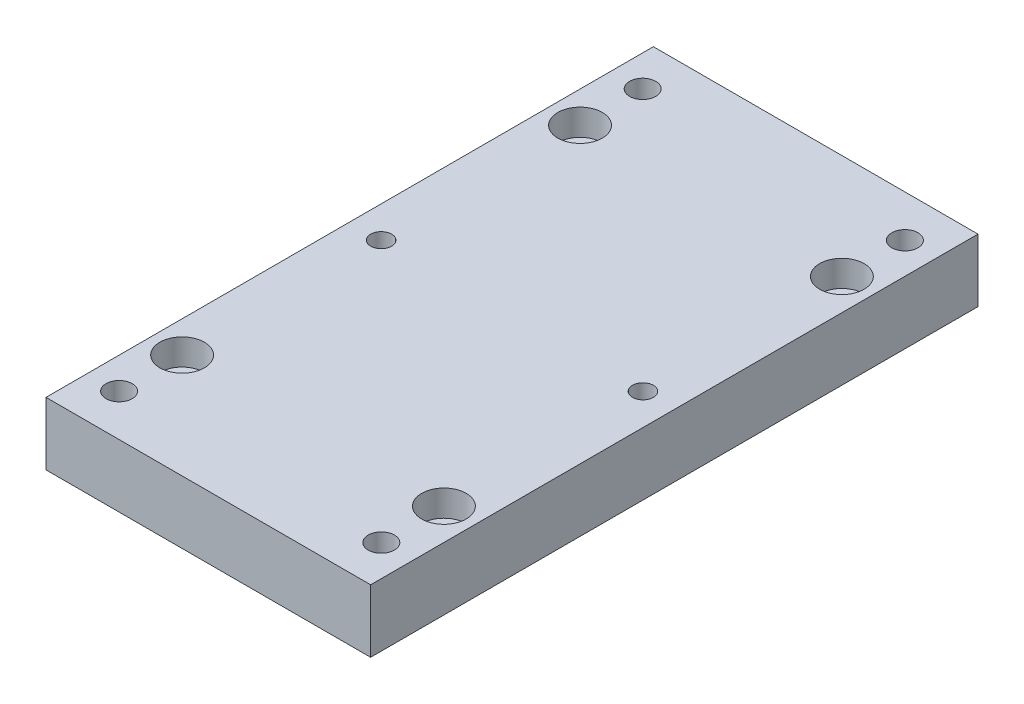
SolidWorks part; units mm, degrees
ref_plane "Front Plane" through (0, 0, 0) normal (0, 0, 1) x (1, 0, 0)
ref_plane "Top Plane" through (0, 0, 0) normal (0, 1, 0) x (1, 0, 0)
ref_plane "Right Plane" through (0, 0, 0) normal (1, 0, 0) x (0, 0, -1)
sketch "Sketch1" plane through (0, 0, 0) normal (0, 1, 0) x (1, 0, 0)
  line L1 (-49.2125, 92.075) -> (49.2125, 92.075)
  line L2 (-49.2125, 92.075) -> (-49.2125, -92.075)
  line L3 (-49.2125, -92.075) -> (49.2125, -92.075)
  line L4 (49.2125, 92.075) -> (49.2125, -92.075)
  line L5 (-49.2125, 92.075) -> (49.2125, -92.075) construction
  line L6 (-49.2125, -92.075) -> (49.2125, 92.075) construction
  point P0 (0, 0)
  dimension "D1" = 98.425
  dimension "D2" = 184.15
extrude "Boss-Extrude1" add sketch "Sketch1" along normal blind 19.05
hole_wizard "CBORE for 5/16 Socket Head Cap Screw1" positions "Sketch2" profile "Sketch3" counterbore size "5/16" standard "ANSI Inch"
sketch "Sketch2" plane through (0, 19.05, 0) normal (0, 1, 0) x (1, 0, 0)
  point P0 (-39.6875, 60.325)
  point P3 (-39.6875, -60.325)
  point P6 (39.6875, 60.325)
  point P9 (39.6875, -60.325)
sketch "Sketch3" plane through (-39.6875, 19.05, -60.325) normal (1, 0, 0) x (0, 0, 1)
  line L0 (0, 0) -> (0, 19.05)
  line L1 (0, 19.05) -> (4.2164, 19.05)
  line L3 (4.2164, 19.05) -> (4.2164, 7.9375)
  line L4 (4.2164, 7.9375) -> (6.7475, 7.9375)
  line L5 (6.7475, 7.9375) -> (6.7475, 0)
  line L7 (6.7475, 0) -> (0, 0)
  line L11 (0, -6.35) -> (0, 107.95) construction
  dimension "Thru Hole Dia." = 8.4328
  dimension "Thru Hole Depth" = 19.05
  dimension "C'Bore Dia." = 13.495
  dimension "C'Bore Depth" = 7.9375
hole_wizard "1/4 (0.2500) Dowel Hole1" positions "Sketch4" profile "Sketch5" hole size "1/4" standard "ANSI Inch"
sketch "Sketch4" plane through (0, 0, 0) normal (0, -1, 0) x (-1, 0, 0)
  point P0 (-39.7002, 0)
  point P3 (39.6748, 0)
sketch "Sketch5" plane through (39.7002, 0, 0) normal (1, 0, 0) x (0, 0, -1)
  line L0 (0, 0) -> (0, 19.05)
  line L1 (0, 19.05) -> (3.175, 19.05)
  line L2 (3.175, 19.05) -> (3.175, 0)
  line L5 (3.175, 0) -> (0, 0)
  line L11 (0, -6.35) -> (0, 107.95) construction
  dimension "Thru Hole Dia." = 6.35
  dimension "Thru Hole Depth" = 19.05
hole_wizard "3/8-16 Tapped Hole1" positions "Sketch6" profile "Sketch7" tap size "3/8-16" standard "ANSI Inch"
sketch "Sketch6" plane through (0, 19.05, 0) normal (0, 1, 0) x (1, 0, 0)
  point P0 (-39.751, 79.375)
  point P2 (39.751, 79.375)
  point P4 (-39.751, -79.375)
  point P6 (39.751, -79.375)
sketch "Sketch7" plane through (-39.751, 19.05, -79.375) normal (1, 0, 0) x (0, 0, 1)
  line L0 (0, 0) -> (0, 19.05)
  line L1 (0, 19.05) -> (3.9687, 19.05)
  line L2 (3.9687, 19.05) -> (3.9687, 0)
  line L5 (3.9687, 0) -> (0, 0)
  line L11 (0, -6.35) -> (0, 107.95) construction
  dimension "Thru Tap Drill Dia." = 7.9375
  dimension "Thru Tap Drill Depth" = 19.05
